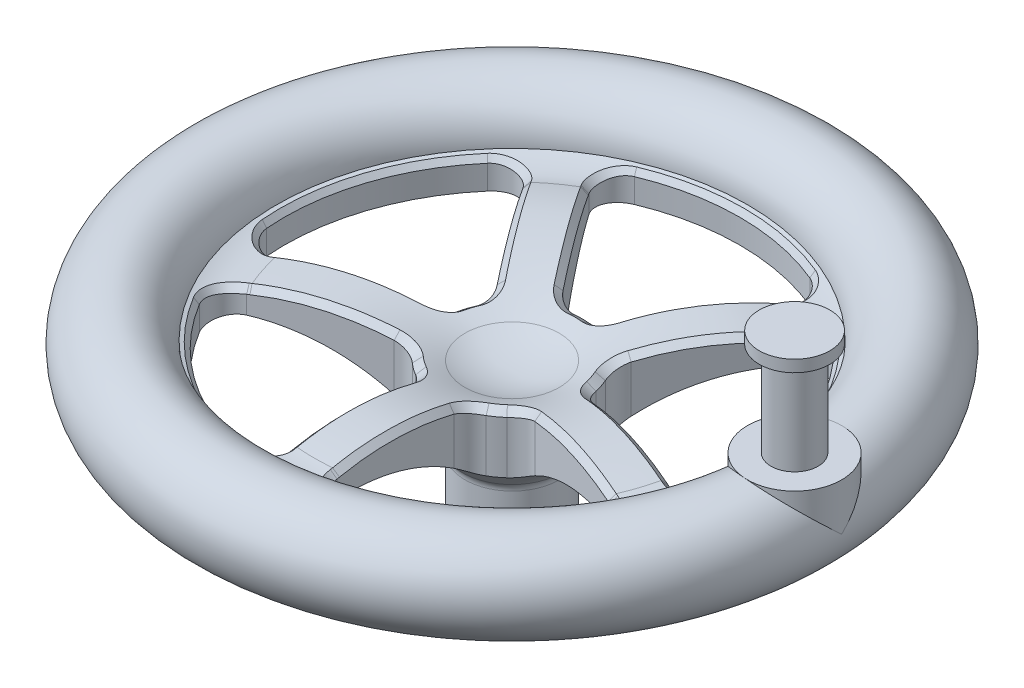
SolidWorks part; units mm, degrees
ref_plane "Front" through (0, 0, 0) normal (0, 0, 1) x (1, 0, 0)
ref_plane "Top" through (0, 0, 0) normal (0, 1, 0) x (1, 0, 0)
ref_plane "Right" through (0, 0, 0) normal (1, 0, 0) x (0, 0, -1)
sketch "Sketch1" plane through (0, 0, 0) normal (0, 0, 1) x (1, 0, 0)
  line L0 (0, 0) -> (0, 38.8183) construction
  line L1 (0, 0) -> (6.35, 0)
  line L2 (6.35, 0) -> (6.35, 12.7)
  line L3 (0, 22.225) -> (38.1, 22.225) construction
  line L4 (0, 0) -> (38.1, 0) construction
  line L5 (38.1, 0) -> (38.1, 25.4) construction
  line L6 (0, 0) -> (0, 22.225)
  line L7 (0, 38.8183) -> (6.35, 23.4881) construction
  arc A0 (6.7342, 13.7355) -> (6.35, 12.7) centre (7.9375, 12.7) ccw
  arc A1 (6.7342, 13.7355) -> (25.2399, 22.225) centre (25.2399, -2.1894) cw
  arc A2 (33.8999, 20.6375) -> (31.7614, 25.7797) centre (38.1, 25.4) ccw
  arc A3 (26.7101, 25.439) -> (6.35, 23.4881) centre (19.7152, -8.7784) ccw
  arc A4 (0, 22.225) -> (6.35, 23.4881) centre (0, 38.8183) ccw
  arc A5 (25.2399, 22.225) -> (33.8999, 20.6375) centre (25.2399, -2.1894) cw
  arc A6 (26.7101, 25.439) -> (31.7614, 25.7797) centre (28.6178, 34.771) ccw
  dimension "D3" = 12.7
  dimension "D6" = 12.7
  dimension "D7" = 9.525
  dimension "D9" = 1.5875
  dimension "D10" = 6.35
  dimension "D11" = 3.175
  dimension "D1" = 22.5
  dimension "D2" = 1.5875
  dimension "D12" = 34.925
  dimension "D4" = 25.4
  dimension "D8" = 22.225
  dimension "Diam" = 76.2
revolve "Base-Revolve" add sketch "Sketch1" angle 360 about L0
sketch "Sketch3" plane through (0, 0, 0) normal (0, 0, 1) x (1, 0, 0)
  line L0 (38.1, 25.4) -> (38.1, 19.05) construction
  line L2 (38.1, 25.4) -> (38.1, 46.0375)
  line L3 (38.1, 46.0375) -> (42.8625, 46.0375)
  line L4 (44.45, 31.75) -> (44.45, 25.4)
  line L5 (44.45, 31.75) -> (41.275, 31.75)
  line L6 (41.275, 44.45) -> (41.275, 31.75)
  line L7 (41.275, 44.45) -> (42.8625, 44.45)
  line L8 (42.8625, 46.0375) -> (42.8625, 44.45)
  line L9 (44.45, 25.4) -> (38.1, 25.4)
  line L11 (38.1, 31.75) -> (44.45, 31.75) construction
  circle A1 centre (38.1, 25.4) radius 6.35 construction
  arc A2 (33.8999, 20.6375) -> (31.7614, 25.7797) centre (38.1, 25.4) ccw construction
  dimension "D1" = 6.35
  dimension "D2" = 9.525
  dimension "D3" = 12.7
  dimension "D4" = 1.5875
revolve "Boss-Revolve1" add sketch "Sketch3" angle 360 about L0
sketch "Sketch2" plane through (0, 0, 0) normal (0, -1, 0) x (1, 0, 0)
  line L0 (0, 0) -> (0, 33.8999) construction
  line L1 (3.175, 26.782) -> (3.175, 10.9985)
  line L2 (-3.175, 30.5348) -> (-3.175, 8.9803) construction
  line L3 (24.49, 11.2957) -> (9.4791, 6.4183)
  line L6 (0, 0) -> (19.9258, 27.4256) construction
  arc A1 (4.7625, 8.2489) -> (3.175, 10.9985) centre (6.35, 10.9985) cw
  circle A2 centre (0, 0) radius 9.525
  arc A3 (6.3735, 7.0785) -> (4.7625, 8.2489) centre (0, 0) ccw
  circle A4 centre (0, 0) radius 30.6995
  circle A5 centre (0, 0) radius 33.8999 construction
  arc A6 (26.2207, 15.9666) -> (7.0825, 29.8713) centre (0, 0) ccw
  arc A7 (7.0825, 29.8713) -> (3.175, 26.782) centre (6.35, 26.782) ccw
  arc A8 (6.3735, 7.0785) -> (9.4791, 6.4183) centre (8.498, 9.4379) ccw
  arc A9 (26.2207, 15.9666) -> (24.49, 11.2957) centre (23.5089, 14.3153) cw
  circle A10 centre (0, 0) radius 33.8999 construction
  point P18 (3.175, 8.9803)
  point P21 (3.175, 30.5348)
  dimension "D4" = 3.175
  dimension "D5" = 36
  dimension "D3" = 6.35
  dimension "D1" = 3.175
  dimension "D2" = 3.2004
extrude "Cut-Extrude1" cut sketch "Sketch2" against normal through all
chamfer "Chamfer2" distance 0.7937 angle 45 19 edges at (-15.6998, 25.439, -21.6089) (3.175, -42.7249, -11.0592) (3.3595, 24.9048, 9.9321) (5.5987, 24.6269, 7.7059) (8.4079, 24.9048, 6.2642) (20.6339, 25.9966, 10.0428) (18.0447, 25.4762, 24.8364) (4.1379, 25.2744, 29.0595) (26.3586, 25.2744, 12.9153) (26.2207, 23.5415, 15.9666) (3.175, 23.7767, 26.782) (7.0825, 23.5415, 29.8713) (24.49, 23.7767, 11.2957) (3.175, 21.555, 10.9985) (9.4791, 21.555, 6.4183) (6.3735, 20.5609, 7.0785) (4.7625, 20.5609, 8.2489)
pattern_circular "CirPattern1" count 5 every 72 about axis through (0, 0, 0) along (0, 1, 0) of "Cut-Extrude1", "Chamfer2"
equation "\"D2@CirPattern1\" = 360/\"D1@CirPattern1\""
equation "\"D5@Sketch2\"= 360/\"D1@CirPattern1\"/2"
equation "\"D12@Sketch1\"=.55*(\"Diam@Sketch1\"-.5)"
